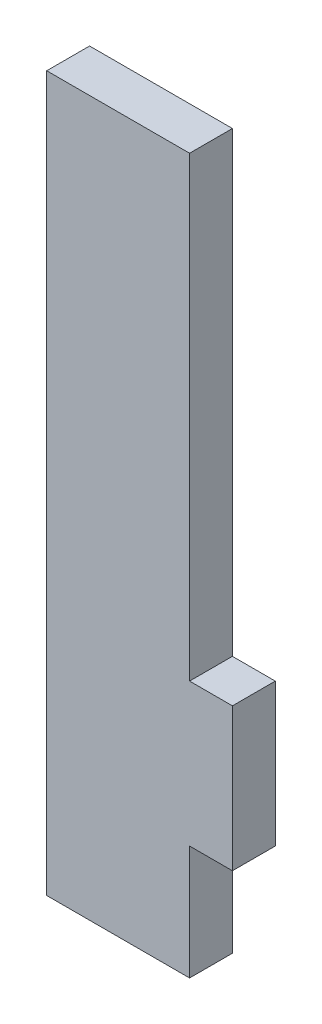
SolidWorks part; units mm, degrees
ref_plane "Plan de face" through (0, 0, 0) normal (0, 0, 1) x (1, 0, 0)
ref_plane "Plan de dessus" through (0, 0, 0) normal (0, 1, 0) x (1, 0, 0)
ref_plane "Plan de droite" through (0, 0, 0) normal (1, 0, 0) x (0, 0, -1)
sketch "Esquisse1" plane through (0, 0, 0) normal (0, 0, 1) x (1, 0, 0)
  line L0 (10, 16) -> (0, 16) construction
  line L1 (0, 0) -> (10, 0)
  line L2 (0, 0) -> (0, 45)
  line L3 (0, 45) -> (10, 45)
  line L4 (10, 0) -> (10, 3)
  line L5 (10, 13) -> (10, 45)
  line L6 (10, 3) -> (13, 3)
  line L8 (10, 13) -> (13, 13)
  line L9 (13, 3) -> (13, 13)
  dimension "D1" = 10
  dimension "D2" = 45
  dimension "D3" = 16
  dimension "D4" = 3
  dimension "D5" = 10
  dimension "D6" = 3
extrude "Boss.-Extru.1" add sketch "Esquisse1" along normal blind 3
sketch "Esquisse2" plane through (0, 0, 0) normal (0, -1, 0) x (1, 0, 0)
  line L5 (0, 0) -> (10, 0)
  line L6 (10, 0) -> (10, 3)
  line L7 (10, 3) -> (0, 3)
  line L8 (0, 3) -> (0, 0)
  line L9 (0, 0) -> (10, 0)
  line L10 (10, 0) -> (10, 3)
  line L11 (10, 3) -> (0, 3)
  line L12 (0, 3) -> (0, 0)
  dimension "D1" = 0
extrude "Boss.-Extru.2" add sketch "Esquisse2" along normal blind 5
